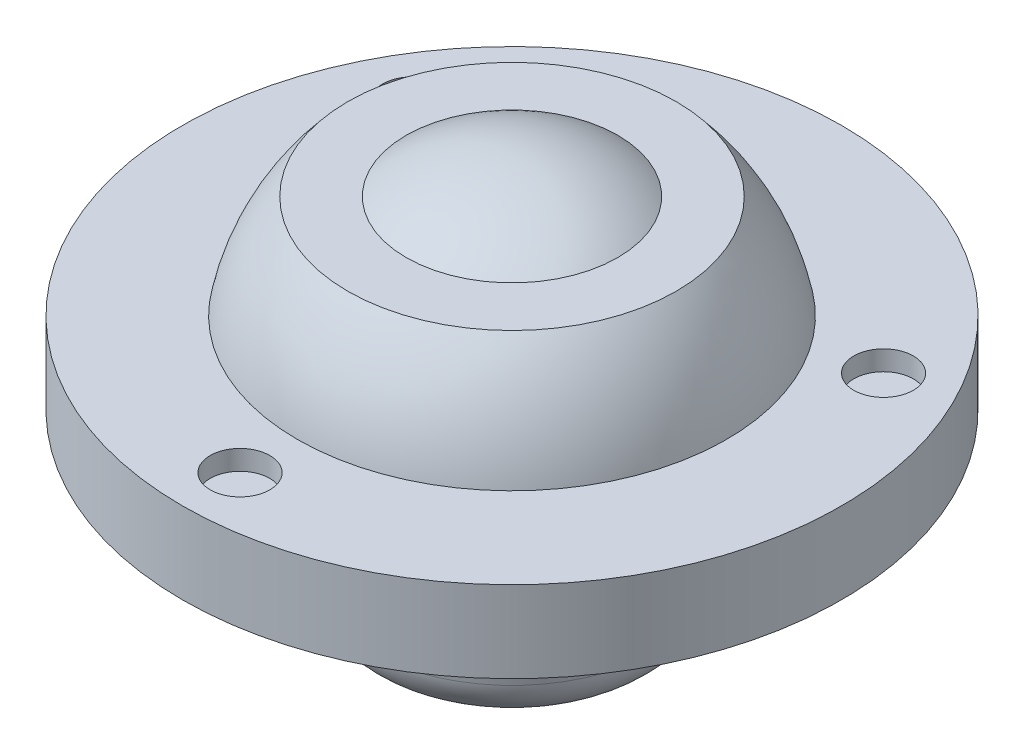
SolidWorks part; units mm, degrees
ref_plane "Plan de face" through (0, 0, 0) normal (0, 0, 1) x (1, 0, 0)
ref_plane "Plan de dessus" through (0, 0, 0) normal (0, 1, 0) x (1, 0, 0)
ref_plane "Plan de droite" through (0, 0, 0) normal (1, 0, 0) x (0, 0, -1)
sketch "Esquisse1" plane through (0, 0, 0) normal (1, 0, 0) x (0, 0, -1)
  line L0 (0, 80.3984) -> (0, -51.4217) construction
  line L1 (50.5904, 0) -> (-66.7414, 0) construction
  line L2 (-15.6, 80.3984) -> (-15.6, -18.8823) construction
  line L3 (-16.8751, 1.05) -> (30.8226, 1.05) construction
  line L4 (-16.8751, -1.05) -> (30.8226, -1.05) construction
  line L5 (-16.8751, -7.35) -> (33.9435, -7.35) construction
  line L6 (-16.8751, 6.25) -> (33.9435, 6.25) construction
  line L7 (25.7772, -10) -> (-16.8751, -10) construction
  line L8 (-6.8883, -5.3313) -> (-6.004, -11.6251) construction
  line L9 (-7.8062, 6.25) -> (-4.9937, 6.25)
  line L10 (-6.4138, -8.7087) -> (-6.5046, -8.0624)
  line L11 (-4.9283, -10) -> (0, -10)
  line L13 (-15.6, 1.05) -> (-9.9447, 1.05)
  line L14 (-15.6, 1.05) -> (-15.6, -1.05)
  line L15 (-15.6, -1.05) -> (-9.9447, -1.05)
  arc A0 (0, 8) -> (-4.9937, 6.25) centre (0, 0) ccw
  arc A1 (-9.9447, -1.05) -> (-6.9478, -7.1922) centre (0, 0) ccw
  arc A2 (-7.8062, 6.25) -> (-9.9447, 1.05) centre (0, 0) ccw
  arc A3 (-4.9283, -10) -> (-6.4138, -8.7087) centre (-4.9283, -8.5) cw
  arc A4 (-6.5046, -8.0624) -> (-6.9478, -7.1922) centre (-7.99, -8.2711) ccw
  point P28 (-6.2323, -10)
  point P34 (-6.5792, -7.5308)
  dimension "D2" = 1.05
  dimension "D6" = 1.5
  dimension "D1" = 15.6
  dimension "D3" = 2.1
  dimension "D4" = 6.3
  dimension "D5" = 13.6
revolve "Révol.-Mince1" add sketch "Esquisse1" angle 360 about L0
sketch "Esquisse2" plane through (0, 2.05, 0) normal (0, 1, 0) x (-1, 0, 0)
  line L0 (0, 17.8357) -> (0, 4.0785) construction
  line L1 (-4.9104, 16.6) -> (16.1516, 16.6) construction
  line L2 (16.1516, 13.7) -> (-4.9104, 13.7) construction
  line L3 (-4.9104, 10.8073) -> (16.1516, 10.8073) construction
  circle A0 centre (0, 13.7) radius 1.5
  circle A1 centre (11.8645, -6.85) radius 1.5
  circle A2 centre (-11.8645, -6.85) radius 1.5
  dimension "D1" = 2.9
extrude "Enlèv. mat.-Extru.1" cut sketch "Esquisse2" against normal blind 10
